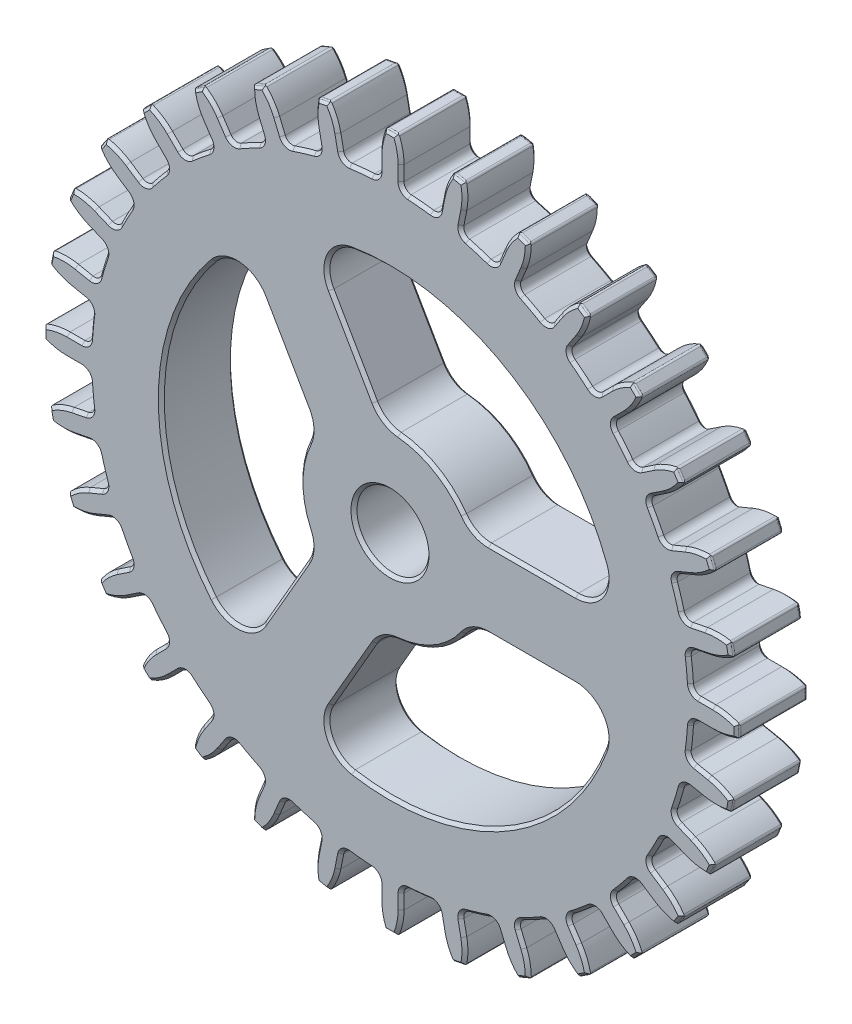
SolidWorks part; units mm, degrees
ref_plane "Спереди" through (0, 0, 0) normal (0, 0, 1) x (1, 0, 0)
ref_plane "Сверху" through (0, 0, 0) normal (0, 1, 0) x (1, 0, 0)
ref_plane "Справа" through (0, 0, 0) normal (1, 0, 0) x (0, 0, -1)
sketch "Эскиз1" plane through (0, 0, 0) normal (0, 0, 1) x (1, 0, 0)
  line L0 (0, 0) -> (0, 28.9) construction
  line L1 (0, 0) -> (-9.525, 16.4978) construction
  line L2 (0, 0) -> (-9.525, -16.4978) construction
  line L3 (-10.5453, 11.765) -> (-6.9157, 5.4784)
  line L4 (-6.9157, -5.4784) -> (-10.5453, -11.765)
  line L5 (15.4614, 3.25) -> (8.2023, 3.25)
  line L6 (-1.2866, 8.7284) -> (-4.9161, 15.015)
  line L7 (-4.9161, -15.015) -> (-1.2866, -8.7284)
  line L8 (8.2023, -3.25) -> (15.4614, -3.25)
  line L9 (15.4614, 3.25) -> (8.2023, 3.25)
  line L10 (-1.2866, 8.7284) -> (-4.9161, 15.015)
  line L11 (-4.9161, -15.015) -> (-1.2866, -8.7284)
  line L12 (8.2023, -3.25) -> (15.4614, -3.25)
  line L13 (-0.919, 26.8921) -> (-0.919, 25.663)
  line L14 (0.919, 26.8921) -> (0.919, 25.663)
  line L15 (6.1477, 26.1961) -> (5.9079, 24.9906)
  line L16 (4.3451, 26.5547) -> (4.1053, 25.3492)
  line L17 (11.1402, 24.4934) -> (10.6698, 23.3578)
  line L18 (9.4421, 25.1967) -> (8.9718, 24.0612)
  line L19 (15.7046, 21.8494) -> (15.0217, 20.8274)
  line L20 (14.1763, 22.8705) -> (13.4935, 21.8486)
  line L21 (19.6654, 18.3658) -> (18.7963, 17.4967)
  line L22 (18.3658, 19.6654) -> (17.4967, 18.7963)
  line L23 (22.8705, 14.1763) -> (21.8486, 13.4935)
  line L24 (21.8494, 15.7046) -> (20.8274, 15.0217)
  line L25 (25.1967, 9.4421) -> (24.0612, 8.9718)
  line L26 (24.4934, 11.1402) -> (23.3578, 10.6698)
  line L27 (26.5547, 4.3451) -> (25.3492, 4.1053)
  line L28 (26.1961, 6.1477) -> (24.9906, 5.9079)
  line L29 (26.8921, -0.919) -> (25.663, -0.919)
  line L30 (26.8921, 0.919) -> (25.663, 0.919)
  line L31 (26.1961, -6.1477) -> (24.9906, -5.9079)
  line L32 (26.5547, -4.3451) -> (25.3492, -4.1053)
  line L33 (24.4934, -11.1402) -> (23.3578, -10.6698)
  line L34 (25.1967, -9.4421) -> (24.0612, -8.9718)
  line L35 (21.8494, -15.7046) -> (20.8274, -15.0217)
  line L36 (22.8705, -14.1763) -> (21.8486, -13.4935)
  line L37 (18.3658, -19.6654) -> (17.4967, -18.7963)
  line L38 (19.6654, -18.3658) -> (18.7963, -17.4967)
  line L39 (14.1763, -22.8705) -> (13.4935, -21.8486)
  line L40 (15.7046, -21.8494) -> (15.0217, -20.8274)
  line L41 (9.4421, -25.1967) -> (8.9718, -24.0612)
  line L42 (11.1402, -24.4934) -> (10.6698, -23.3578)
  line L43 (4.3451, -26.5547) -> (4.1053, -25.3492)
  line L44 (6.1477, -26.1961) -> (5.9079, -24.9906)
  line L45 (-0.919, -26.8921) -> (-0.919, -25.663)
  line L46 (0.919, -26.8921) -> (0.919, -25.663)
  line L47 (-6.1477, -26.1961) -> (-5.9079, -24.9906)
  line L48 (-4.3451, -26.5547) -> (-4.1053, -25.3492)
  line L49 (-11.1402, -24.4934) -> (-10.6698, -23.3578)
  line L50 (-9.4421, -25.1967) -> (-8.9718, -24.0612)
  line L51 (-15.7046, -21.8494) -> (-15.0217, -20.8274)
  line L52 (-14.1763, -22.8705) -> (-13.4935, -21.8486)
  line L53 (-19.6654, -18.3658) -> (-18.7963, -17.4967)
  line L54 (-18.3658, -19.6654) -> (-17.4967, -18.7963)
  line L55 (-22.8705, -14.1763) -> (-21.8486, -13.4935)
  line L56 (-21.8494, -15.7046) -> (-20.8274, -15.0217)
  line L57 (-25.1967, -9.4421) -> (-24.0612, -8.9718)
  line L58 (-24.4934, -11.1402) -> (-23.3578, -10.6698)
  line L59 (-26.5547, -4.3451) -> (-25.3492, -4.1053)
  line L60 (-26.1961, -6.1477) -> (-24.9906, -5.9079)
  line L61 (-26.8921, 0.919) -> (-25.663, 0.919)
  line L62 (-26.8921, -0.919) -> (-25.663, -0.919)
  line L63 (-26.1961, 6.1477) -> (-24.9906, 5.9079)
  line L64 (-26.5547, 4.3451) -> (-25.3492, 4.1053)
  line L65 (-24.4934, 11.1402) -> (-23.3578, 10.6698)
  line L66 (-25.1967, 9.4421) -> (-24.0612, 8.9718)
  line L67 (-21.8494, 15.7046) -> (-20.8274, 15.0217)
  line L68 (-22.8705, 14.1763) -> (-21.8486, 13.4935)
  line L69 (-18.3658, 19.6654) -> (-17.4967, 18.7963)
  line L70 (-19.6654, 18.3658) -> (-18.7963, 17.4967)
  line L71 (-14.1763, 22.8705) -> (-13.4935, 21.8486)
  line L72 (-15.7046, 21.8494) -> (-15.0217, 20.8274)
  line L73 (-9.4421, 25.1967) -> (-8.9718, 24.0612)
  line L74 (-11.1402, 24.4934) -> (-10.6698, 23.3578)
  line L75 (-4.3451, 26.5547) -> (-4.1053, 25.3492)
  line L76 (-6.1477, 26.1961) -> (-5.9079, 24.9906)
  circle A0 centre (0, 0) radius 3
  arc A1 (-1.5156, 25.0292) -> (-3.3965, 24.8439) centre (0, 0) ccw
  circle A2 centre (0, 0) radius 27.2 construction
  arc A3 (0.5, 28.8957) -> (-0.5, 28.8957) centre (0, 0) ccw
  arc A4 (-14.7058, 12.1096) -> (-14.7058, -12.1096) centre (0, 0) ccw
  arc A5 (-6.8093, 3.1437) -> (-6.8093, -3.1437) centre (0, 0) ccw
  arc A6 (-6.9157, 5.4784) -> (-6.8093, 3.1437) centre (-9.1154, 4.2084) cw
  arc A7 (-6.9157, -5.4784) -> (-6.8093, -3.1437) centre (-9.1154, -4.2084) ccw
  arc A8 (-10.5453, -11.765) -> (-14.7058, -12.1096) centre (-12.745, -10.495) cw
  arc A9 (-10.5453, 11.765) -> (-14.7058, 12.1096) centre (-12.745, 10.495) ccw
  arc A10 (15.4614, 3.25) -> (17.8401, 6.6808) centre (15.4614, 5.79) ccw
  arc A11 (17.8401, 6.6808) -> (-3.1343, 18.7904) centre (0, 0) ccw
  arc A12 (8.2023, 3.25) -> (6.1272, 4.3252) centre (8.2023, 5.79) cw
  arc A13 (6.1272, 4.3252) -> (0.6821, 7.4689) centre (0, 0) ccw
  arc A14 (-1.2866, 8.7284) -> (0.6821, 7.4689) centre (0.9131, 9.9984) ccw
  arc A15 (-4.9161, -15.015) -> (-3.1343, -18.7904) centre (-2.7164, -16.285) ccw
  arc A16 (-3.1343, -18.7904) -> (17.8401, -6.6808) centre (0, 0) ccw
  arc A17 (-1.2866, -8.7284) -> (0.6821, -7.4689) centre (0.9131, -9.9984) cw
  arc A18 (0.6821, -7.4689) -> (6.1272, -4.3252) centre (0, 0) ccw
  arc A19 (8.2023, -3.25) -> (6.1272, -4.3252) centre (8.2023, -5.79) ccw
  arc A20 (15.4614, 3.25) -> (17.8401, 6.6808) centre (15.4614, 5.79) ccw
  arc A21 (17.8401, 6.6808) -> (-3.1343, 18.7904) centre (0, 0) ccw
  arc A22 (8.2023, 3.25) -> (6.1272, 4.3252) centre (8.2023, 5.79) cw
  arc A23 (6.1272, 4.3252) -> (0.6821, 7.4689) centre (0, 0) ccw
  arc A24 (-1.2866, 8.7284) -> (0.6821, 7.4689) centre (0.9131, 9.9984) ccw
  arc A25 (-4.9161, 15.015) -> (-3.1343, 18.7904) centre (-2.7164, 16.285) cw
  arc A26 (-4.9161, -15.015) -> (-3.1343, -18.7904) centre (-2.7164, -16.285) ccw
  arc A27 (-3.1343, -18.7904) -> (17.8401, -6.6808) centre (0, 0) ccw
  arc A28 (-1.2866, -8.7284) -> (0.6821, -7.4689) centre (0.9131, -9.9984) cw
  arc A29 (0.6821, -7.4689) -> (6.1272, -4.3252) centre (0, 0) ccw
  arc A30 (8.2023, -3.25) -> (6.1272, -4.3252) centre (8.2023, -5.79) ccw
  arc A31 (15.4614, -3.25) -> (17.8401, -6.6808) centre (15.4614, -5.79) cw
  arc A32 (-0.5, 28.8957) -> (-0.919, 26.8921) centre (4.081, 26.8921) ccw
  arc A33 (0.5, 28.8957) -> (0.919, 26.8921) centre (-4.081, 26.8921) cw
  arc A34 (5.1469, 28.438) -> (4.3451, 26.5547) centre (9.249, 25.5792) ccw
  arc A35 (6.1277, 28.2429) -> (5.1469, 28.438) centre (0, 0) ccw
  arc A36 (6.1277, 28.2429) -> (6.1477, 26.1961) centre (1.2438, 27.1715) cw
  arc A37 (10.596, 26.8875) -> (9.4421, 25.1967) centre (14.0615, 23.2833) ccw
  arc A38 (11.5198, 26.5048) -> (10.596, 26.8875) centre (0, 0) ccw
  arc A39 (11.5198, 26.5048) -> (11.1402, 24.4934) centre (6.5208, 26.4068) cw
  arc A40 (15.6378, 24.3037) -> (14.1763, 22.8705) centre (18.3337, 20.0927) ccw
  arc A41 (16.4693, 23.7481) -> (15.6378, 24.3037) centre (0, 0) ccw
  arc A42 (16.4693, 23.7481) -> (15.7046, 21.8494) centre (11.5472, 24.6273) cw
  arc A43 (20.0788, 20.7859) -> (18.3658, 19.6654) centre (21.9013, 16.1299) ccw
  arc A44 (20.7859, 20.0788) -> (20.0788, 20.7859) centre (0, 0) ccw
  arc A45 (20.7859, 20.0788) -> (19.6654, 18.3658) centre (16.1299, 21.9013) cw
  arc A46 (23.7481, 16.4693) -> (21.8494, 15.7046) centre (24.6273, 11.5472) ccw
  arc A47 (24.3037, 15.6378) -> (23.7481, 16.4693) centre (0, 0) ccw
  arc A48 (24.3037, 15.6378) -> (22.8705, 14.1763) centre (20.0927, 18.3337) cw
  arc A49 (26.5048, 11.5198) -> (24.4934, 11.1402) centre (26.4068, 6.5208) ccw
  arc A50 (26.8875, 10.596) -> (26.5048, 11.5198) centre (0, 0) ccw
  arc A51 (26.8875, 10.596) -> (25.1967, 9.4421) centre (23.2833, 14.0615) cw
  arc A52 (28.2429, 6.1277) -> (26.1961, 6.1477) centre (27.1715, 1.2438) ccw
  arc A53 (28.438, 5.1469) -> (28.2429, 6.1277) centre (0, 0) ccw
  arc A54 (28.438, 5.1469) -> (26.5547, 4.3451) centre (25.5792, 9.249) cw
  arc A55 (28.8957, 0.5) -> (26.8921, 0.919) centre (26.8921, -4.081) ccw
  arc A56 (28.8957, -0.5) -> (28.8957, 0.5) centre (0, 0) ccw
  arc A57 (28.8957, -0.5) -> (26.8921, -0.919) centre (26.8921, 4.081) cw
  arc A58 (28.438, -5.1469) -> (26.5547, -4.3451) centre (25.5792, -9.249) ccw
  arc A59 (28.2429, -6.1277) -> (28.438, -5.1469) centre (0, 0) ccw
  arc A60 (28.2429, -6.1277) -> (26.1961, -6.1477) centre (27.1715, -1.2438) cw
  arc A61 (26.8875, -10.596) -> (25.1967, -9.4421) centre (23.2833, -14.0615) ccw
  arc A62 (26.5048, -11.5198) -> (26.8875, -10.596) centre (0, 0) ccw
  arc A63 (26.5048, -11.5198) -> (24.4934, -11.1402) centre (26.4068, -6.5208) cw
  arc A64 (24.3037, -15.6378) -> (22.8705, -14.1763) centre (20.0927, -18.3337) ccw
  arc A65 (23.7481, -16.4693) -> (24.3037, -15.6378) centre (0, 0) ccw
  arc A66 (23.7481, -16.4693) -> (21.8494, -15.7046) centre (24.6273, -11.5472) cw
  arc A67 (20.7859, -20.0788) -> (19.6654, -18.3658) centre (16.1299, -21.9013) ccw
  arc A68 (20.0788, -20.7859) -> (20.7859, -20.0788) centre (0, 0) ccw
  arc A69 (20.0788, -20.7859) -> (18.3658, -19.6654) centre (21.9013, -16.1299) cw
  arc A70 (16.4693, -23.7481) -> (15.7046, -21.8494) centre (11.5472, -24.6273) ccw
  arc A71 (15.6378, -24.3037) -> (16.4693, -23.7481) centre (0, 0) ccw
  arc A72 (15.6378, -24.3037) -> (14.1763, -22.8705) centre (18.3337, -20.0927) cw
  arc A73 (11.5198, -26.5048) -> (11.1402, -24.4934) centre (6.5208, -26.4068) ccw
  arc A74 (10.596, -26.8875) -> (11.5198, -26.5048) centre (0, 0) ccw
  arc A75 (10.596, -26.8875) -> (9.4421, -25.1967) centre (14.0615, -23.2833) cw
  arc A76 (6.1277, -28.2429) -> (6.1477, -26.1961) centre (1.2438, -27.1715) ccw
  arc A77 (5.1469, -28.438) -> (6.1277, -28.2429) centre (0, 0) ccw
  arc A78 (5.1469, -28.438) -> (4.3451, -26.5547) centre (9.249, -25.5792) cw
  arc A79 (0.5, -28.8957) -> (0.919, -26.8921) centre (-4.081, -26.8921) ccw
  arc A80 (-0.5, -28.8957) -> (0.5, -28.8957) centre (0, 0) ccw
  arc A81 (-0.5, -28.8957) -> (-0.919, -26.8921) centre (4.081, -26.8921) cw
  arc A82 (-5.1469, -28.438) -> (-4.3451, -26.5547) centre (-9.249, -25.5792) ccw
  arc A83 (-6.1277, -28.2429) -> (-5.1469, -28.438) centre (0, 0) ccw
  arc A84 (-6.1277, -28.2429) -> (-6.1477, -26.1961) centre (-1.2438, -27.1715) cw
  arc A85 (-10.596, -26.8875) -> (-9.4421, -25.1967) centre (-14.0615, -23.2833) ccw
  arc A86 (-11.5198, -26.5048) -> (-10.596, -26.8875) centre (0, 0) ccw
  arc A87 (-11.5198, -26.5048) -> (-11.1402, -24.4934) centre (-6.5208, -26.4068) cw
  arc A88 (-15.6378, -24.3037) -> (-14.1763, -22.8705) centre (-18.3337, -20.0927) ccw
  arc A89 (-16.4693, -23.7481) -> (-15.6378, -24.3037) centre (0, 0) ccw
  arc A90 (-16.4693, -23.7481) -> (-15.7046, -21.8494) centre (-11.5472, -24.6273) cw
  arc A91 (-20.0788, -20.7859) -> (-18.3658, -19.6654) centre (-21.9013, -16.1299) ccw
  arc A92 (-20.7859, -20.0788) -> (-20.0788, -20.7859) centre (0, 0) ccw
  arc A93 (-20.7859, -20.0788) -> (-19.6654, -18.3658) centre (-16.1299, -21.9013) cw
  arc A94 (-23.7481, -16.4693) -> (-21.8494, -15.7046) centre (-24.6273, -11.5472) ccw
  arc A95 (-24.3037, -15.6378) -> (-23.7481, -16.4693) centre (0, 0) ccw
  arc A96 (-24.3037, -15.6378) -> (-22.8705, -14.1763) centre (-20.0927, -18.3337) cw
  arc A97 (-26.5048, -11.5198) -> (-24.4934, -11.1402) centre (-26.4068, -6.5208) ccw
  arc A98 (-26.8875, -10.596) -> (-26.5048, -11.5198) centre (0, 0) ccw
  arc A99 (-26.8875, -10.596) -> (-25.1967, -9.4421) centre (-23.2833, -14.0615) cw
  arc A100 (-28.2429, -6.1277) -> (-26.1961, -6.1477) centre (-27.1715, -1.2438) ccw
  arc A101 (-28.438, -5.1469) -> (-28.2429, -6.1277) centre (0, 0) ccw
  arc A102 (-28.438, -5.1469) -> (-26.5547, -4.3451) centre (-25.5792, -9.249) cw
  arc A103 (-28.8957, -0.5) -> (-26.8921, -0.919) centre (-26.8921, 4.081) ccw
  arc A104 (-28.8957, 0.5) -> (-28.8957, -0.5) centre (0, 0) ccw
  arc A105 (-28.8957, 0.5) -> (-26.8921, 0.919) centre (-26.8921, -4.081) cw
  arc A106 (-28.438, 5.1469) -> (-26.5547, 4.3451) centre (-25.5792, 9.249) ccw
  arc A107 (-28.2429, 6.1277) -> (-28.438, 5.1469) centre (0, 0) ccw
  arc A108 (-28.2429, 6.1277) -> (-26.1961, 6.1477) centre (-27.1715, 1.2438) cw
  arc A109 (-26.8875, 10.596) -> (-25.1967, 9.4421) centre (-23.2833, 14.0615) ccw
  arc A110 (-26.5048, 11.5198) -> (-26.8875, 10.596) centre (0, 0) ccw
  arc A111 (-26.5048, 11.5198) -> (-24.4934, 11.1402) centre (-26.4068, 6.5208) cw
  arc A112 (-24.3037, 15.6378) -> (-22.8705, 14.1763) centre (-20.0927, 18.3337) ccw
  arc A113 (-23.7481, 16.4693) -> (-24.3037, 15.6378) centre (0, 0) ccw
  arc A114 (-23.7481, 16.4693) -> (-21.8494, 15.7046) centre (-24.6273, 11.5472) cw
  arc A115 (-20.7859, 20.0788) -> (-19.6654, 18.3658) centre (-16.1299, 21.9013) ccw
  arc A116 (-20.0788, 20.7859) -> (-20.7859, 20.0788) centre (0, 0) ccw
  arc A117 (-20.0788, 20.7859) -> (-18.3658, 19.6654) centre (-21.9013, 16.1299) cw
  arc A118 (-16.4693, 23.7481) -> (-15.7046, 21.8494) centre (-11.5472, 24.6273) ccw
  arc A119 (-15.6378, 24.3037) -> (-16.4693, 23.7481) centre (0, 0) ccw
  arc A120 (-15.6378, 24.3037) -> (-14.1763, 22.8705) centre (-18.3337, 20.0927) cw
  arc A121 (-11.5198, 26.5048) -> (-11.1402, 24.4934) centre (-6.5208, 26.4068) ccw
  arc A122 (-10.596, 26.8875) -> (-11.5198, 26.5048) centre (0, 0) ccw
  arc A123 (-10.596, 26.8875) -> (-9.4421, 25.1967) centre (-14.0615, 23.2833) cw
  arc A124 (-6.1277, 28.2429) -> (-6.1477, 26.1961) centre (-1.2438, 27.1715) ccw
  arc A125 (-5.1469, 28.438) -> (-6.1277, 28.2429) centre (0, 0) ccw
  arc A126 (-5.1469, 28.438) -> (-4.3451, 26.5547) centre (-9.249, 25.5792) cw
  arc A127 (3.3965, 24.8439) -> (1.5156, 25.0292) centre (0, 0) ccw
  arc A128 (-6.3694, 24.2525) -> (-8.178, 23.7039) centre (0, 0) ccw
  arc A129 (-10.9785, 22.5439) -> (-12.6453, 21.653) centre (0, 0) ccw
  arc A130 (-15.1656, 19.969) -> (-16.6266, 18.77) centre (0, 0) ccw
  arc A131 (8.178, 23.7039) -> (6.3694, 24.2525) centre (0, 0) ccw
  arc A132 (12.6453, 21.653) -> (10.9785, 22.5439) centre (0, 0) ccw
  arc A133 (16.6266, 18.77) -> (15.1656, 19.969) centre (0, 0) ccw
  arc A134 (19.969, 15.1656) -> (18.77, 16.6266) centre (0, 0) ccw
  arc A135 (22.5439, 10.9785) -> (21.653, 12.6453) centre (0, 0) ccw
  arc A136 (24.2525, 6.3694) -> (23.7039, 8.178) centre (0, 0) ccw
  arc A137 (25.0292, 1.5156) -> (24.8439, 3.3965) centre (0, 0) ccw
  arc A138 (24.8439, -3.3965) -> (25.0292, -1.5156) centre (0, 0) ccw
  arc A139 (23.7039, -8.178) -> (24.2525, -6.3694) centre (0, 0) ccw
  arc A140 (21.653, -12.6453) -> (22.5439, -10.9785) centre (0, 0) ccw
  arc A141 (-18.77, 16.6266) -> (-19.969, 15.1656) centre (0, 0) ccw
  arc A142 (-21.653, 12.6453) -> (-22.5439, 10.9785) centre (0, 0) ccw
  arc A143 (-23.7039, 8.178) -> (-24.2525, 6.3694) centre (0, 0) ccw
  arc A144 (-24.8439, 3.3965) -> (-25.0292, 1.5156) centre (0, 0) ccw
  arc A145 (-25.0292, -1.5156) -> (-24.8439, -3.3965) centre (0, 0) ccw
  arc A146 (-24.2525, -6.3694) -> (-23.7039, -8.178) centre (0, 0) ccw
  arc A147 (-22.5439, -10.9785) -> (-21.653, -12.6453) centre (0, 0) ccw
  arc A148 (-19.969, -15.1656) -> (-18.77, -16.6266) centre (0, 0) ccw
  arc A149 (-16.6266, -18.77) -> (-15.1656, -19.969) centre (0, 0) ccw
  arc A150 (-12.6453, -21.653) -> (-10.9785, -22.5439) centre (0, 0) ccw
  arc A151 (-8.178, -23.7039) -> (-6.3694, -24.2525) centre (0, 0) ccw
  arc A152 (-3.3965, -24.8439) -> (-1.5156, -25.0292) centre (0, 0) ccw
  arc A153 (1.5156, -25.0292) -> (3.3965, -24.8439) centre (0, 0) ccw
  arc A154 (6.3694, -24.2525) -> (8.178, -23.7039) centre (0, 0) ccw
  arc A155 (10.9785, -22.5439) -> (12.6453, -21.653) centre (0, 0) ccw
  arc A156 (15.1656, -19.969) -> (16.6266, -18.77) centre (0, 0) ccw
  arc A157 (18.77, -16.6266) -> (19.969, -15.1656) centre (0, 0) ccw
  arc A158 (-8.9718, -24.0612) -> (-8.178, -23.7039) centre (-8.3851, -24.3042) cw
  arc A159 (-5.9079, -24.9906) -> (-6.3694, -24.2525) centre (-6.5307, -24.8667) ccw
  arc A160 (-4.1053, -25.3492) -> (-3.3965, -24.8439) centre (-3.4825, -25.4731) cw
  arc A161 (-0.919, -25.663) -> (-1.5156, -25.0292) centre (-1.554, -25.663) ccw
  arc A162 (0.919, -25.663) -> (1.5156, -25.0292) centre (1.554, -25.663) cw
  arc A163 (4.1053, -25.3492) -> (3.3965, -24.8439) centre (3.4825, -25.4731) ccw
  arc A164 (-10.6698, -23.3578) -> (-10.9785, -22.5439) centre (-11.2565, -23.1148) ccw
  arc A165 (-13.4935, -21.8486) -> (-12.6453, -21.653) centre (-12.9655, -22.2013) cw
  arc A166 (-15.0217, -20.8274) -> (-15.1656, -19.969) centre (-15.5497, -20.4747) ccw
  arc A167 (-17.4967, -18.7963) -> (-16.6266, -18.77) centre (-17.0476, -19.2453) cw
  arc A168 (-18.7963, -17.4967) -> (-18.77, -16.6266) centre (-19.2453, -17.0476) ccw
  arc A169 (-20.8274, -15.0217) -> (-19.969, -15.1656) centre (-20.4747, -15.5497) cw
  arc A170 (-21.8486, -13.4935) -> (-21.653, -12.6453) centre (-22.2013, -12.9655) ccw
  arc A171 (-23.3578, -10.6698) -> (-22.5439, -10.9785) centre (-23.1148, -11.2565) cw
  arc A172 (-24.0612, -8.9718) -> (-23.7039, -8.178) centre (-24.3042, -8.3851) ccw
  arc A173 (-24.9906, -5.9079) -> (-24.2525, -6.3694) centre (-24.8667, -6.5307) cw
  arc A174 (-25.3492, -4.1053) -> (-24.8439, -3.3965) centre (-25.4731, -3.4825) ccw
  arc A175 (-25.663, -0.919) -> (-25.0292, -1.5156) centre (-25.663, -1.554) cw
  arc A176 (-25.663, 0.919) -> (-25.0292, 1.5156) centre (-25.663, 1.554) ccw
  arc A177 (-25.3492, 4.1053) -> (-24.8439, 3.3965) centre (-25.4731, 3.4825) cw
  arc A178 (-24.9906, 5.9079) -> (-24.2525, 6.3694) centre (-24.8667, 6.5307) ccw
  arc A179 (-24.0612, 8.9718) -> (-23.7039, 8.178) centre (-24.3042, 8.3851) cw
  arc A180 (-23.3578, 10.6698) -> (-22.5439, 10.9785) centre (-23.1148, 11.2565) ccw
  arc A181 (-21.8486, 13.4935) -> (-21.653, 12.6453) centre (-22.2013, 12.9655) cw
  arc A182 (-20.8274, 15.0217) -> (-19.969, 15.1656) centre (-20.4747, 15.5497) ccw
  arc A183 (-18.7963, 17.4967) -> (-18.77, 16.6266) centre (-19.2453, 17.0476) cw
  arc A184 (-17.4967, 18.7963) -> (-16.6266, 18.77) centre (-17.0476, 19.2453) ccw
  arc A185 (-15.0217, 20.8274) -> (-15.1656, 19.969) centre (-15.5497, 20.4747) cw
  arc A186 (-13.4935, 21.8486) -> (-12.6453, 21.653) centre (-12.9655, 22.2013) ccw
  arc A187 (-10.6698, 23.3578) -> (-10.9785, 22.5439) centre (-11.2565, 23.1148) cw
  arc A188 (5.9079, -24.9906) -> (6.3694, -24.2525) centre (6.5307, -24.8667) cw
  arc A189 (8.9718, -24.0612) -> (8.178, -23.7039) centre (8.3851, -24.3042) ccw
  arc A190 (10.6698, -23.3578) -> (10.9785, -22.5439) centre (11.2565, -23.1148) cw
  arc A191 (13.4935, -21.8486) -> (12.6453, -21.653) centre (12.9655, -22.2013) ccw
  arc A192 (17.4967, -18.7963) -> (16.6266, -18.77) centre (17.0476, -19.2453) ccw
  arc A193 (15.0217, -20.8274) -> (15.1656, -19.969) centre (15.5497, -20.4747) cw
  arc A194 (18.7963, -17.4967) -> (18.77, -16.6266) centre (19.2453, -17.0476) cw
  arc A195 (20.8274, -15.0217) -> (19.969, -15.1656) centre (20.4747, -15.5497) ccw
  arc A196 (21.8486, -13.4935) -> (21.653, -12.6453) centre (22.2013, -12.9655) cw
  arc A197 (23.3578, -10.6698) -> (22.5439, -10.9785) centre (23.1148, -11.2565) ccw
  arc A198 (24.0612, -8.9718) -> (23.7039, -8.178) centre (24.3042, -8.3851) cw
  arc A199 (24.9906, -5.9079) -> (24.2525, -6.3694) centre (24.8667, -6.5307) ccw
  arc A200 (25.3492, -4.1053) -> (24.8439, -3.3965) centre (25.4731, -3.4825) cw
  arc A201 (25.663, -0.919) -> (25.0292, -1.5156) centre (25.663, -1.554) ccw
  arc A202 (25.663, 0.919) -> (25.0292, 1.5156) centre (25.663, 1.554) cw
  arc A203 (25.3492, 4.1053) -> (24.8439, 3.3965) centre (25.4731, 3.4825) ccw
  arc A204 (24.9906, 5.9079) -> (24.2525, 6.3694) centre (24.8667, 6.5307) cw
  arc A205 (24.0612, 8.9718) -> (23.7039, 8.178) centre (24.3042, 8.3851) ccw
  arc A206 (23.3578, 10.6698) -> (22.5439, 10.9785) centre (23.1148, 11.2565) cw
  arc A207 (21.8486, 13.4935) -> (21.653, 12.6453) centre (22.2013, 12.9655) ccw
  arc A208 (20.8274, 15.0217) -> (19.969, 15.1656) centre (20.4747, 15.5497) cw
  arc A209 (18.7963, 17.4967) -> (18.77, 16.6266) centre (19.2453, 17.0476) ccw
  arc A210 (17.4967, 18.7963) -> (16.6266, 18.77) centre (17.0476, 19.2453) cw
  arc A211 (15.0217, 20.8274) -> (15.1656, 19.969) centre (15.5497, 20.4747) ccw
  arc A212 (13.4935, 21.8486) -> (12.6453, 21.653) centre (12.9655, 22.2013) cw
  arc A213 (10.6698, 23.3578) -> (10.9785, 22.5439) centre (11.2565, 23.1148) ccw
  arc A214 (8.9718, 24.0612) -> (8.178, 23.7039) centre (8.3851, 24.3042) cw
  arc A215 (5.9079, 24.9906) -> (6.3694, 24.2525) centre (6.5307, 24.8667) ccw
  arc A216 (4.1053, 25.3492) -> (3.3965, 24.8439) centre (3.4825, 25.4731) cw
  arc A217 (0.919, 25.663) -> (1.5156, 25.0292) centre (1.554, 25.663) ccw
  arc A218 (-0.919, 25.663) -> (-1.5156, 25.0292) centre (-1.554, 25.663) cw
  arc A219 (-8.9718, 24.0612) -> (-8.178, 23.7039) centre (-8.3851, 24.3042) ccw
  arc A220 (-5.9079, 24.9906) -> (-6.3694, 24.2525) centre (-6.5307, 24.8667) cw
  arc A221 (-4.1053, 25.3492) -> (-3.3965, 24.8439) centre (-3.4825, 25.4731) ccw
  point P3 (-33.7237, -11.3235)
  point P477 (0.919, 25.0582)
  point P480 (-0.919, 25.0582)
  dimension "D1" = 6
  dimension "D2" = 50.15
  dimension "D3" = 54.4
  dimension "D4" = 57.8
  dimension "D5" = 38.1
  dimension "D6" = 15
  dimension "D11" = 2.54
  dimension "D14" = 10
  dimension "D17" = 0.635
  dimension "D7" = 30
  dimension "D8" = 30
  dimension "D9" = 6.5
  dimension "D10" = 6.5
  dimension "D15" = 1
  dimension "D16" = 32
  dimension "D12" = 3
  dimension "D13" = 3
extrude "Бобышка-Вытянуть1" add sketch "Эскиз1" along normal blind 6 contours A221 L75 A126 A125 A124 L76 A220 A128 A219 L73 A123 A122 A121 L74 A187 A129 A186 L71 A120 A119 A118 L72 A185 A130 A184 L69 A117 A116 A115 L70 A183 A141 A182 L67 A114 A113 A112 L68 A181 A142 A180 L65 A111 A110 A109 L66 A179 A143 A178 L63 A108
chamfer "Фаска1" distance 0.25 angle 45 400 edges at (17.5488, -4.3428, 0) (9.525, -16.4978, 0) (-5.0135, -17.3691, 0) (-3.1013, -11.8717, 0) (-0.4557, -7.8588, 0) (3.75, -6.4952, 0) (7.0337, -3.5348, 0) (11.8319, -3.25, 0) (3, 0, 0) (-8.7305, 8.6217, 0) (-6.5781, 4.324, 0) (-7.5, 0, 0) (-6.5781, -4.324, 0) (-8.7305, -8.6217, 0) (-12.5353, -13.0263, 0) (-19.05, 0, 0) (-12.5353, 13.0263, 0) (-5.0135, 17.3691, 0) (9.525, 16.4978, 0) (17.5488, 4.3428, 0) (11.8319, 3.25, 0) (7.0337, 3.5348, 0) (3.75, 6.4952, 0) (-0.4557, 7.8588, 0) (-3.1013, 11.8717, 0) (-4.2252, 25.9519, 0) (-4.6486, 27.5378, 0) (-5.6381, 28.3447, 0) (-6.2435, 27.2205, 0) (-6.0278, 25.5933, 0) (-5.9923, 24.5301, 0) (-7.2789, 23.9953, 0) (-8.6457, 23.7252, 0) (-9.207, 24.629, 0) (-9.9316, 26.1018, 0) (-11.0596, 26.7001, 0) (-11.434, 25.4794, 0) (-10.905, 23.9256, 0) (-10.6628, 22.8897, 0) (-11.8203, 22.1142, 0) (-13.1082, 21.5826, 0) (-13.8349, 22.3595, 0) (-14.833, 23.6627, 0) (-16.056, 24.0295, 0) (-16.1851, 22.7592, 0) (-15.3631, 21.3384, 0) (-14.9234, 20.3697, 0) (-15.9074, 19.3832, 0) (-17.0668, 18.6106, 0) (-17.9312, 19.2309, 0) (-19.1643, 20.3142, 0) (-20.4354, 20.4354, 0) (-20.3142, 19.1643, 0) (-19.2309, 17.9312, 0) (-18.6106, 17.0668, 0) (-19.3832, 15.9074, 0) (-20.3697, 14.9234, 0) (-21.3384, 15.3631, 0) (-22.7592, 16.1851, 0) (-24.0295, 16.056, 0) (-23.6627, 14.833, 0) (-22.3595, 13.8349, 0) (-21.5826, 13.1082, 0) (-22.1142, 11.8203, 0) (-22.8897, 10.6628, 0) (-23.9256, 10.905, 0) (-25.4794, 11.434, 0) (-26.7001, 11.0596, 0) (-26.1018, 9.9316, 0) (-24.629, 9.207, 0) (-23.7252, 8.6457, 0) (-23.9953, 7.2789, 0) (-24.5301, 5.9923, 0) (-25.5933, 6.0278, 0) (-27.2205, 6.2435, 0) (-28.3447, 5.6381, 0) (-27.5378, 4.6486, 0) (-25.9519, 4.2252, 0) (-24.956, 3.8511, 0) (-24.9543, 2.4578, 0) (-25.2278, 1.0916, 0) (-26.2775, 0.919, 0) (-27.9156, 0.8131, 0) (-28.9, 0, 0) (-27.9156, -0.8131, 0) (-26.2775, -0.919, 0) (-25.2278, -1.0916, 0) (-24.9543, -2.4578, 0) (-24.956, -3.8511, 0) (-25.9519, -4.2252, 0) (-27.5378, -4.6486, 0) (-28.3447, -5.6381, 0) (-27.2205, -6.2435, 0) (-25.5933, -6.0278, 0) (-24.5301, -5.9923, 0) (-23.9953, -7.2789, 0) (-23.7252, -8.6457, 0) (-24.629, -9.207, 0) (-26.1018, -9.9316, 0) (-26.7001, -11.0596, 0) (-25.4794, -11.434, 0) (-23.9256, -10.905, 0) (-22.8897, -10.6628, 0) (-22.1142, -11.8203, 0) (-21.5826, -13.1082, 0) (-22.3595, -13.8349, 0) (-23.6627, -14.833, 0) (-24.0295, -16.056, 0) (-22.7592, -16.1851, 0) (-21.3384, -15.3631, 0) (-20.3697, -14.9234, 0) (-19.3832, -15.9074, 0) (-18.6106, -17.0668, 0) (-19.2309, -17.9312, 0) (-20.3142, -19.1643, 0) (-20.4354, -20.4354, 0) (-19.1643, -20.3142, 0) (-17.9312, -19.2309, 0) (-17.0668, -18.6106, 0) (-15.9074, -19.3832, 0) (-14.9234, -20.3697, 0) (-15.3631, -21.3384, 0) (-16.1851, -22.7592, 0) (-16.056, -24.0295, 0) (-14.833, -23.6627, 0) (-13.8349, -22.3595, 0) (-13.1082, -21.5826, 0) (-11.8203, -22.1142, 0) (-10.6628, -22.8897, 0) (-10.905, -23.9256, 0) (-11.434, -25.4794, 0) (-11.0596, -26.7001, 0) (-9.9316, -26.1018, 0) (-9.207, -24.629, 0) (-8.6457, -23.7252, 0) (-7.2789, -23.9953, 0) (-5.9923, -24.5301, 0) (-6.0278, -25.5933, 0) (-6.2435, -27.2205, 0) (-5.6381, -28.3447, 0) (-4.6486, -27.5378, 0) (-4.2252, -25.9519, 0) (-3.8511, -24.956, 0) (-2.4578, -24.9543, 0) (-1.0916, -25.2278, 0) (-0.919, -26.2775, 0) (-0.8131, -27.9156, 0) (0, -28.9, 0) (0.8131, -27.9156, 0) (0.919, -26.2775, 0) (1.0916, -25.2278, 0) (2.4578, -24.9543, 0) (3.8511, -24.956, 0) (4.2252, -25.9519, 0) (4.6486, -27.5378, 0) (5.6381, -28.3447, 0) (6.2435, -27.2205, 0) (6.0278, -25.5933, 0) (5.9923, -24.5301, 0) (7.2789, -23.9953, 0) (8.6457, -23.7252, 0) (9.207, -24.629, 0) (9.9316, -26.1018, 0) (11.0596, -26.7001, 0) (11.434, -25.4794, 0) (10.905, -23.9256, 0) (10.6628, -22.8897, 0) (11.8203, -22.1142, 0) (13.1082, -21.5826, 0) (13.8349, -22.3595, 0) (14.833, -23.6627, 0) (16.056, -24.0295, 0) (16.1851, -22.7592, 0) (15.3631, -21.3384, 0) (14.9234, -20.3697, 0) (15.9074, -19.3832, 0) (17.0668, -18.6106, 0) (17.9312, -19.2309, 0) (19.1643, -20.3142, 0) (20.4354, -20.4354, 0) (20.3142, -19.1643, 0) (19.2309, -17.9312, 0) (18.6106, -17.0668, 0) (19.3832, -15.9074, 0) (20.3697, -14.9234, 0) (21.3384, -15.3631, 0) (22.7592, -16.1851, 0) (24.0295, -16.056, 0) (23.6627, -14.833, 0) (22.3595, -13.8349, 0) (21.5826, -13.1082, 0) (22.1142, -11.8203, 0) (22.8897, -10.6628, 0) (23.9256, -10.905, 0) (25.4794, -11.434, 0) (26.7001, -11.0596, 0) (26.1018, -9.9316, 0) (24.629, -9.207, 0) (23.7252, -8.6457, 0) (23.9953, -7.2789, 0) (24.5301, -5.9923, 0) (25.5933, -6.0278, 0) (27.2205, -6.2435, 0) (28.3447, -5.6381, 0) (27.5378, -4.6486, 0) (25.9519, -4.2252, 0) (24.956, -3.8511, 0) (24.9543, -2.4578, 0) (25.2278, -1.0916, 0) (26.2775, -0.919, 0) (27.9156, -0.8131, 0) (28.9, 0, 0) (27.9156, 0.8131, 0) (26.2775, 0.919, 0) (25.2278, 1.0916, 0) (24.9543, 2.4578, 0) (24.956, 3.8511, 0) (25.9519, 4.2252, 0) (27.5378, 4.6486, 0) (28.3447, 5.6381, 0) (27.2205, 6.2435, 0) (25.5933, 6.0278, 0) (24.5301, 5.9923, 0) (23.9953, 7.2789, 0) (23.7252, 8.6457, 0) (24.629, 9.207, 0) (26.1018, 9.9316, 0) (26.7001, 11.0596, 0) (25.4794, 11.434, 0) (23.9256, 10.905, 0) (22.8897, 10.6628, 0) (22.1142, 11.8203, 0) (21.5826, 13.1082, 0) (22.3595, 13.8349, 0) (23.6627, 14.833, 0) (24.0295, 16.056, 0) (22.7592, 16.1851, 0) (21.3384, 15.3631, 0) (20.3697, 14.9234, 0) (19.3832, 15.9074, 0) (18.6106, 17.0668, 0) (19.2309, 17.9312, 0) (20.3142, 19.1643, 0) (20.4354, 20.4354, 0) (19.1643, 20.3142, 0) (17.9312, 19.2309, 0) (17.0668, 18.6106, 0) (15.9074, 19.3832, 0) (14.9234, 20.3697, 0) (15.3631, 21.3384, 0) (16.1851, 22.7592, 0) (16.056, 24.0295, 0) (14.833, 23.6627, 0) (13.8349, 22.3595, 0) (13.1082, 21.5826, 0) (11.8203, 22.1142, 0) (10.6628, 22.8897, 0) (10.905, 23.9256, 0) (11.434, 25.4794, 0) (11.0596, 26.7001, 0) (9.9316, 26.1018, 0) (9.207, 24.629, 0) (8.6457, 23.7252, 0) (7.2789, 23.9953, 0) (5.9923, 24.5301, 0) (6.0278, 25.5933, 0) (6.2435, 27.2205, 0) (5.6381, 28.3447, 0) (4.6486, 27.5378, 0) (4.2252, 25.9519, 0) (3.8511, 24.956, 0) (2.4578, 24.9543, 0) (1.0916, 25.2278, 0) (0.919, 26.2775, 0) (0.8131, 27.9156, 0) (0, 28.9, 0) (-0.8131, 27.9156, 0) (-0.919, 26.2775, 0) (-1.0916, 25.2278, 0) (-2.4578, 24.9543, 0) (-3.8511, 24.956, 0) (7.0337, -3.5348, 6) (3.75, -6.4952, 6) (-0.4557, -7.8588, 6) (-3.1013, -11.8717, 6) (-5.0135, -17.3691, 6) (9.525, -16.4978, 6) (17.5488, -4.3428, 6) (11.8319, -3.25, 6) (3, 0, 6) (-19.05, 0, 6) (-12.5353, -13.0263, 6) (-8.7305, -8.6217, 6) (-6.5781, -4.324, 6) (-7.5, 0, 6) (-6.5781, 4.324, 6) (-8.7305, 8.6217, 6) (-12.5353, 13.0263, 6) (-0.4557, 7.8588, 6) (3.75, 6.4952, 6) (7.0337, 3.5348, 6) (11.8319, 3.25, 6) (17.5488, 4.3428, 6) (9.525, 16.4978, 6) (-5.0135, 17.3691, 6) (-3.1013, 11.8717, 6) (-2.4578, 24.9543, 6) (-1.0916, 25.2278, 6) (-0.919, 26.2775, 6) (-0.8131, 27.9156, 6) (0, 28.9, 6) (0.8131, 27.9156, 6) (0.919, 26.2775, 6) (1.0916, 25.2278, 6) (2.4578, 24.9543, 6) (3.8511, 24.956, 6) (4.2252, 25.9519, 6) (4.6486, 27.5378, 6) (5.6381, 28.3447, 6) (6.2435, 27.2205, 6) (6.0278, 25.5933, 6) (5.9923, 24.5301, 6) (7.2789, 23.9953, 6) (8.6457, 23.7252, 6) (9.207, 24.629, 6) (9.9316, 26.1018, 6) (11.0596, 26.7001, 6) (11.434, 25.4794, 6) (10.905, 23.9256, 6) (10.6628, 22.8897, 6) (11.8203, 22.1142, 6) (13.1082, 21.5826, 6) (13.8349, 22.3595, 6) (14.833, 23.6627, 6) (16.056, 24.0295, 6) (16.1851, 22.7592, 6) (15.3631, 21.3384, 6) (14.9234, 20.3697, 6) (15.9074, 19.3832, 6) (17.0668, 18.6106, 6) (17.9312, 19.2309, 6) (19.1643, 20.3142, 6) (20.4354, 20.4354, 6) (20.3142, 19.1643, 6) (19.2309, 17.9312, 6) (18.6106, 17.0668, 6) (19.3832, 15.9074, 6) (20.3697, 14.9234, 6) (21.3384, 15.3631, 6) (22.7592, 16.1851, 6) (24.0295, 16.056, 6) (23.6627, 14.833, 6) (22.3595, 13.8349, 6) (21.5826, 13.1082, 6) (22.1142, 11.8203, 6) (22.8897, 10.6628, 6) (23.9256, 10.905, 6) (25.4794, 11.434, 6) (26.7001, 11.0596, 6) (26.1018, 9.9316, 6) (24.629, 9.207, 6) (23.7252, 8.6457, 6) (23.9953, 7.2789, 6) (24.5301, 5.9923, 6) (25.5933, 6.0278, 6) (27.2205, 6.2435, 6) (28.3447, 5.6381, 6) (27.5378, 4.6486, 6) (25.9519, 4.2252, 6) (24.956, 3.8511, 6) (24.9543, 2.4578, 6) (25.2278, 1.0916, 6) (26.2775, 0.919, 6) (27.9156, 0.8131, 6) (28.9, 0, 6) (27.9156, -0.8131, 6) (26.2775, -0.919, 6) (25.2278, -1.0916, 6) (24.9543, -2.4578, 6) (24.956, -3.8511, 6) (25.9519, -4.2252, 6) (27.5378, -4.6486, 6) (28.3447, -5.6381, 6) (27.2205, -6.2435, 6) (25.5933, -6.0278, 6) (24.5301, -5.9923, 6) (23.9953, -7.2789, 6) (23.7252, -8.6457, 6) (24.629, -9.207, 6) (26.1018, -9.9316, 6) (26.7001, -11.0596, 6) (25.4794, -11.434, 6) (23.9256, -10.905, 6) (22.8897, -10.6628, 6) (22.1142, -11.8203, 6) (21.5826, -13.1082, 6) (22.3595, -13.8349, 6) (23.6627, -14.833, 6) (24.0295, -16.056, 6) (22.7592, -16.1851, 6)
fillet "Скругление1" radius 0.2 120 edges at (20.4354, -20.4354, 5.75) (20.7859, -20.0788, 3) (20.4354, -20.4354, 0.25) (20.0788, -20.7859, 3) (16.056, -24.0295, 5.75) (16.4693, -23.7481, 3) (16.056, -24.0295, 0.25) (15.6378, -24.3037, 3) (11.0596, -26.7001, 5.75) (11.5198, -26.5048, 3) (11.0596, -26.7001, 0.25) (10.596, -26.8875, 3) (5.6381, -28.3447, 5.75) (6.1277, -28.2429, 3) (5.6381, -28.3447, 0.25) (5.1469, -28.438, 3) (0, -28.9, 5.75) (0.5, -28.8957, 3) (0, -28.9, 0.25) (-0.5, -28.8957, 3) (-5.6381, -28.3447, 5.75) (-5.1469, -28.438, 3) (-5.6381, -28.3447, 0.25) (-11.0596, -26.7001, 5.75) (-10.596, -26.8875, 3) (-11.0596, -26.7001, 0.25) (-11.5198, -26.5048, 3) (-16.056, -24.0295, 5.75) (-15.6378, -24.3037, 3) (-16.056, -24.0295, 0.25) (-20.4354, -20.4354, 5.75) (-20.0788, -20.7859, 3) (-20.7859, -20.0788, 3) (-23.7481, -16.4693, 3) (-24.0295, -16.056, 0.25) (-24.3037, -15.6378, 3) (-11.0596, 26.7001, 5.75) (-11.5198, 26.5048, 3) (-11.0596, 26.7001, 0.25) (-10.596, 26.8875, 3) (-26.7001, 11.0596, 5.75) (-26.8875, 10.596, 3) (-26.7001, 11.0596, 0.25) (-26.5048, 11.5198, 3) (-16.056, 24.0295, 5.75) (-16.4693, 23.7481, 3) (-16.056, 24.0295, 0.25) (-15.6378, 24.3037, 3) (-20.4354, 20.4354, 5.75) (-20.7859, 20.0788, 3) (-20.4354, 20.4354, 0.25) (-20.0788, 20.7859, 3) (-24.0295, 16.056, 5.75) (-24.3037, 15.6378, 3) (-24.0295, 16.056, 0.25) (-23.7481, 16.4693, 3) (-28.3447, 5.6381, 5.75) (-28.438, 5.1469, 3) (-28.3447, 5.6381, 0.25) (-28.2429, 6.1277, 3) (-28.9, 0, 5.75) (-28.8957, -0.5, 3) (-28.9, 0, 0.25) (-28.8957, 0.5, 3) (-28.3447, -5.6381, 5.75) (-28.438, -5.1469, 3) (-26.7001, -11.0596, 5.75) (-26.5048, -11.5198, 3) (-26.7001, -11.0596, 0.25) (-26.8875, -10.596, 3) (24.0295, -16.056, 5.75) (24.3037, -15.6378, 3) (24.0295, -16.056, 0.25) (23.7481, -16.4693, 3) (26.7001, -11.0596, 5.75) (26.8875, -10.596, 3) (26.7001, -11.0596, 0.25) (26.5048, -11.5198, 3) (28.3447, -5.6381, 5.75) (28.438, -5.1469, 3) (28.3447, -5.6381, 0.25) (28.2429, -6.1277, 3) (28.9, 0, 5.75) (28.8957, 0.5, 3) (28.9, 0, 0.25) (28.3447, 5.6381, 5.75) (28.2429, 6.1277, 3) (28.3447, 5.6381, 0.25) (28.438, 5.1469, 3) (26.7001, 11.0596, 5.75) (26.5048, 11.5198, 3) (26.7001, 11.0596, 0.25) (24.0295, 16.056, 5.75) (23.7481, 16.4693, 3) (24.0295, 16.056, 0.25) (24.3037, 15.6378, 3) (20.4354, 20.4354, 5.75) (20.0788, 20.7859, 3) (20.4354, 20.4354, 0.25) (20.7859, 20.0788, 3) (16.056, 24.0295, 5.75) (15.6378, 24.3037, 3) (16.056, 24.0295, 0.25) (16.4693, 23.7481, 3) (11.0596, 26.7001, 5.75) (10.596, 26.8875, 3) (11.0596, 26.7001, 0.25) (11.5198, 26.5048, 3) (5.6381, 28.3447, 5.75) (5.1469, 28.438, 3) (5.6381, 28.3447, 0.25) (6.1277, 28.2429, 3) (0, 28.9, 5.75) (-0.5, 28.8957, 3) (0, 28.9, 0.25) (0.5, 28.8957, 3) (-5.6381, 28.3447, 5.75) (-6.1277, 28.2429, 3) (-5.6381, 28.3447, 0.25) (-5.1469, 28.438, 3)
